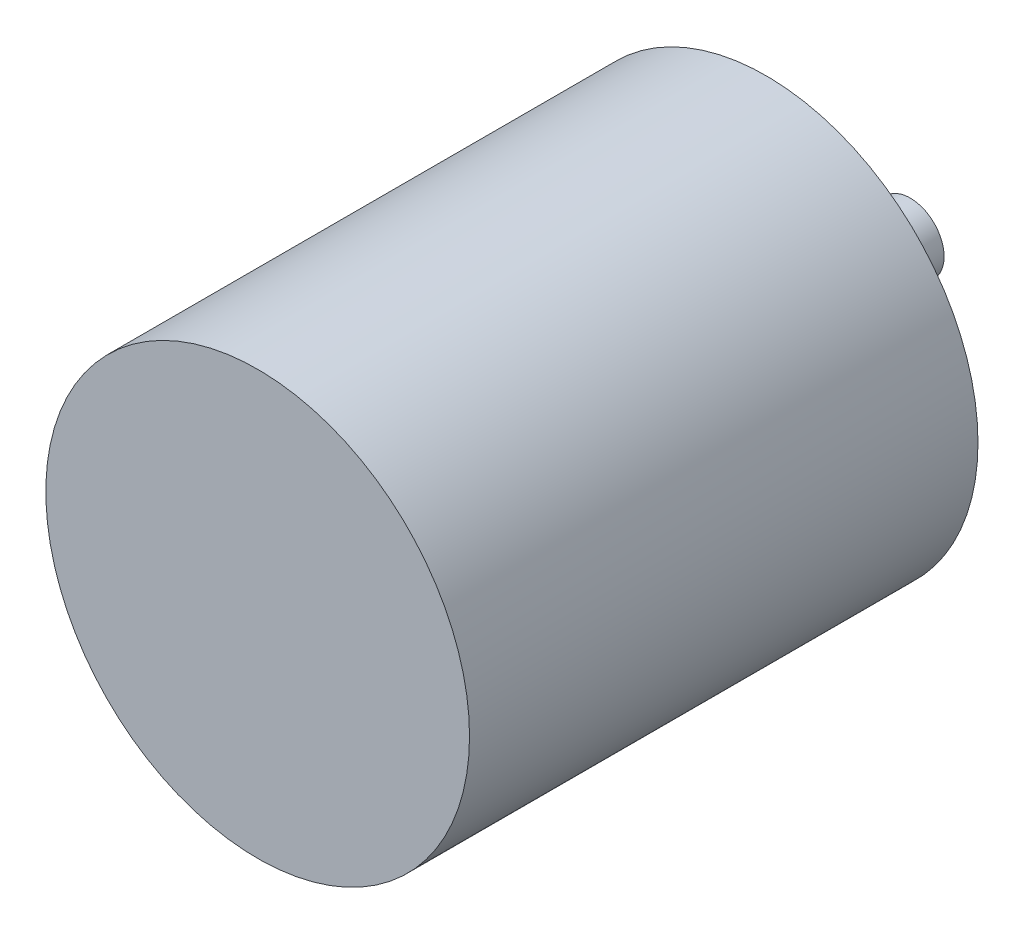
SolidWorks part; units mm, degrees
ref_plane "Front Plane" through (0, 0, 0) normal (0, 0, 1) x (1, 0, 0)
ref_plane "Top Plane" through (0, 0, 0) normal (0, 1, 0) x (1, 0, 0)
ref_plane "Right Plane" through (0, 0, 0) normal (1, 0, 0) x (0, 0, -1)
sketch "Sketch2" plane through (0, 0, 0) normal (0, 0, 1) x (1, 0, 0)
  circle A0 centre (0, 0) radius 25
  dimension "D1" = 50
extrude "Boss-Extrude1" add sketch "Sketch2" along normal blind 60
sketch "Sketch3" plane through (0, 0, 0) normal (0, 0, 1) x (1, 0, 0)
  circle A0 centre (0, 0) radius 4
  dimension "D1" = 8
extrude "Boss-Extrude2" add sketch "Sketch3" against normal blind 17
sketch "Sketch4" plane through (0, 0, 0) normal (0, 0, -1) x (-1, 0, 0)
  line L1 (-10, 10) -> (10, 10) construction
  line L2 (-10, 10) -> (-10, -10) construction
  line L3 (-10, -10) -> (10, -10) construction
  line L4 (10, 10) -> (10, -10) construction
  line L5 (-10, 10) -> (10, -10) construction
  line L6 (-10, -10) -> (10, 10) construction
  circle A0 centre (10, 10) radius 3
  circle A1 centre (-10, 10) radius 3
  circle A2 centre (-10, -10) radius 3
  circle A3 centre (10, -10) radius 3
  point P0 (0, 0)
  dimension "D3" = 6
  dimension "D1" = 20
  dimension "D2" = 20
extrude "Cut-Extrude1" cut sketch "Sketch4" against normal blind 7
